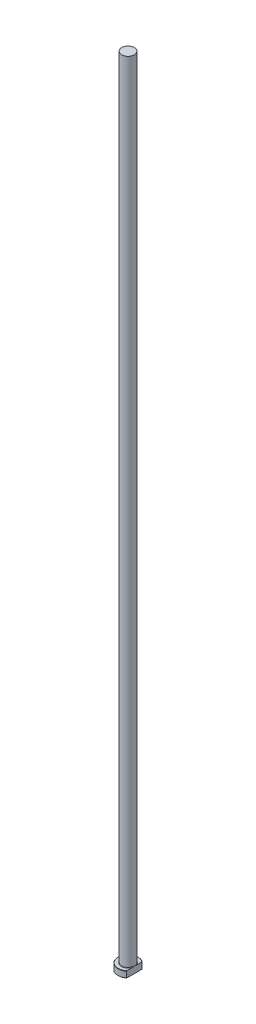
SolidWorks part; units mm, degrees
ref_plane "Front Plane" through (0, 0, 0) normal (0, 0, 1) x (1, 0, 0)
ref_plane "Top Plane" through (0, 0, 0) normal (0, 1, 0) x (1, 0, 0)
ref_plane "Right Plane" through (0, 0, 0) normal (1, 0, 0) x (0, 0, -1)
sketch "Sketch1" plane through (0, 0, 0) normal (0, 0, 1) x (1, 0, 0)
  line L0 (0, 259.9588) -> (0, -15.1925) construction
  line L1 (0, 0) -> (-8, 0)
  line L2 (-8, 0) -> (-8, 5)
  line L3 (-8, 5) -> (-5, 5)
  line L4 (-5, 5) -> (-5, 630)
  line L5 (-5, 630) -> (0, 630)
  line L6 (0, 630) -> (0, 0)
  dimension "L" = 630
  dimension "H" = 16
  dimension "T" = 5
  dimension "D" = 10
revolve "Revolve1" add sketch "Sketch1" angle 360 about L0
chamfer "Chamfer1" distance 0.2 angle 45 2 edges at (0, 5, 8) (0, 0, 8)
fillet "Fillet1" radius 0.3 1 edges at (0, 5, 5)
sketch "Sketch2" plane through (0, 0, 0) normal (0, 1, 0) x (1, 0, 0)
  line L0 (5, 6.245) -> (5, -6.245)
  circle A0 centre (0, 0) radius 8 construction
  arc A1 (5, -6.245) -> (5, 6.245) centre (0, 0) ccw
  circle A2 centre (0, 0) radius 5 construction
extrude "KEY" cut sketch "Sketch2" along normal through all
